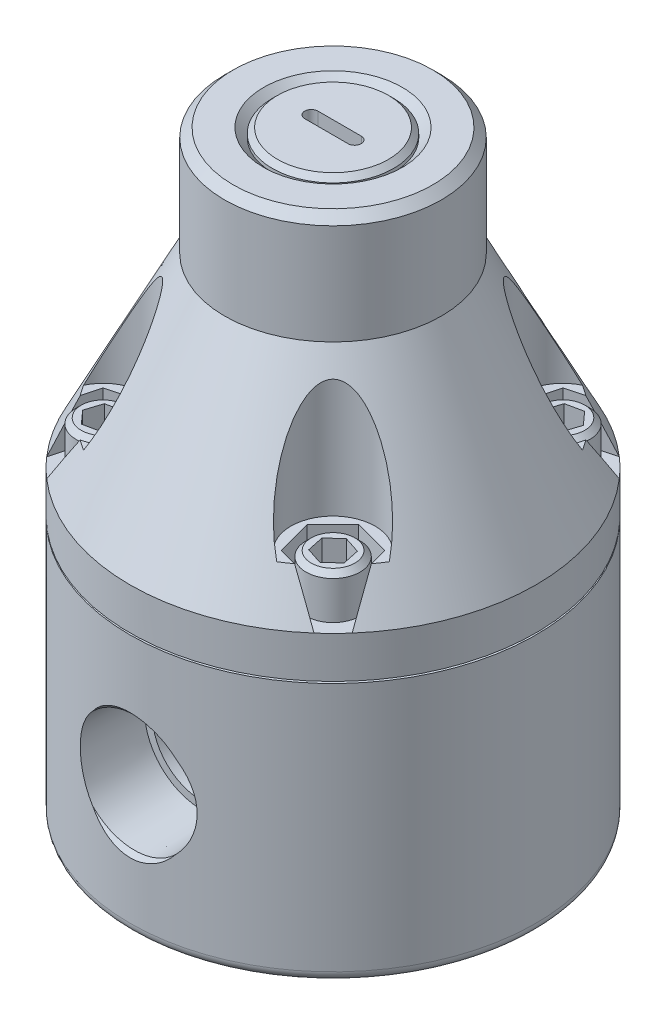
SolidWorks part; units mm, degrees
ref_plane "Front Plane" through (0, 0, 0) normal (0, 0, 1) x (1, 0, 0)
ref_plane "Top Plane" through (0, 0, 0) normal (0, 1, 0) x (1, 0, 0)
ref_plane "Right Plane" through (0, 0, 0) normal (1, 0, 0) x (0, 0, -1)
sketch "Sketch1" plane through (0, 0, 0) normal (0, 1, 0) x (1, 0, 0)
  circle A0 centre (0, 0) radius 29.718
  dimension "D1" = 59.436
extrude "Extrude1" add sketch "Sketch1" along normal blind 87.63
sketch "Sketch2" plane through (0, 0, 0) normal (0, 0, 1) x (1, 0, 0)
  line L0 (0, 0) -> (0, 87.63) construction
  line L1 (29.718, 87.63) -> (-29.718, 87.63) construction
  line L2 (-34.5439, 38.1) -> (-19.05, 38.1)
  line L3 (-19.05, 38.1) -> (-19.05, 38.354)
  line L4 (-19.05, 38.354) -> (-29.718, 38.354)
  line L5 (-15.875, 71.628) -> (-15.875, 89.2885)
  line L6 (-15.875, 89.2885) -> (-34.5439, 89.2885)
  line L7 (-34.5439, 89.2885) -> (-34.5439, 38.1)
  line L8 (-29.718, 87.63) -> (-29.718, 0) construction
  line L9 (-29.718, 38.354) -> (-29.718, 44.45)
  line L10 (-29.718, 0) -> (29.718, 0) construction
  line L11 (-29.718, 44.45) -> (-15.875, 71.628)
  dimension "D1" = 38.1
  dimension "D2" = 0.254
  dimension "D3" = 6.35
  dimension "D4" = 27.178
  dimension "D5" = 15.875
  dimension "D6" = 19.05
revolve "Cut-Revolve1" cut sketch "Sketch2" angle 360 about L0
ref_plane "Plane1" through (0, 87.63, 0) normal (0, 1, 0) x (-1, 0, 0)
sketch "Sketch3" plane through (0, 87.63, 0) normal (0, 1, 0) x (-1, 0, 0)
  circle A0 centre (0, 0) radius 10.16
  dimension "D1" = 20.32
extrude "Extrude2" cut sketch "Sketch3" against normal blind 1.27 draft 45
ref_plane "Plane2" through (0, 0, 29.718) normal (0, 0, 1) x (1, 0, 0)
sketch "Sketch4" plane through (0, 0, 29.718) normal (0, 0, 1) x (1, 0, 0)
  line L0 (0, 0) -> (0, 19.05) construction
  dimension "D1" = 19.05
hole_wizard "3/8 NPT Tapped Hole1" positions "3DSketch3" profile "Sketch6" size "3/8" standard "Ansi Inch"
sketch3d "3DSketch3"
  point P0 (0, 19.05, 29.718)
  point P4 (0, 19.05, 29.718)
sketch "Sketch6" plane through (0, 19.05, 29.718) normal (1, 0, 0) x (0, -1, 0)
  line L0 (0, 0) -> (0, 20.4824)
  line L1 (7.1374, 17.526) -> (0, 20.4824)
  line L2 (-7.1374, 17.526) -> (0, 20.4824) construction
  line L3 (7.1374, 17.526) -> (7.1374, 10.414)
  line L4 (7.1374, 10.414) -> (8.2822, 10.414)
  line L5 (8.2822, 10.414) -> (8.575, 0.635)
  line L6 (8.575, 0.635) -> (9.21, 0)
  line L7 (9.21, 0) -> (0, 0)
  line L8 (0, -6.35) -> (0, 107.95) construction
  line L9 (-8.575, 0.635) -> (-9.21, 0) construction
  line L11 (-7.1374, 10.414) -> (-8.2822, 10.414) construction
  line L12 (-8.2822, 10.414) -> (-8.575, 0.635) construction
  dimension "Tap Drill Dia." = 14.2748
  dimension "Tap Drill Depth" = 17.526
  dimension "Thread Dia." = 17.15
  dimension "Thread Angle" = 3.43
  dimension "Thread Depth" = 10.414
  dimension "C'Sink Dia." = 18.42
  dimension "C'Sink Angle" = 90
  dimension "Drill Angle" = 135
pattern_circular "CirPattern1" count 2 over 360 about axis through (0, 87.63, 0) along (0, -1, 0) of "3/8 NPT Tapped Hole1"
chamfer "Chamfer1" distance 1.27 angle 45 1 edges at (0, 87.63, 15.875)
fillet "Fillet1" radius 1.524 1 edges at (0, 0, 29.718)
sketch "Sketch7" plane through (0, 87.63, 0) normal (0, 1, 0) x (-1, 0, 0)
  circle A0 centre (0, 0) radius 8.89
extrude "Extrude4" add sketch "Sketch7" against normal up to surface (1.27 mm away)
sketch "Sketch10" plane through (0, 87.63, 0) normal (0, 1, 0) x (-1, 0, 0)
  line L0 (-3.175, 0) -> (3.175, 0) construction
  line L1 (-3.175, 0.9652) -> (3.175, 0.9652)
  line L2 (-3.175, -0.9652) -> (3.175, -0.9652)
  arc A0 (-3.175, 0.9652) -> (-3.175, -0.9652) centre (-3.175, 0) ccw
  arc A1 (3.175, 0.9652) -> (3.175, -0.9652) centre (3.175, 0) cw
  dimension "D1" = 3.175
  dimension "D2" = 6.35
  dimension "D3" = 0.9652
  dimension "D4" = 0.9652
  dimension "D5" = 3.175
  dimension "D6" = 6.35
extrude "Extrude5" cut sketch "Sketch10" against normal blind 4.7498
chamfer "Chamfer4" distance 0.762 angle 45 1 edges at (0, 87.63, 8.89)
ref_plane "Plane3" through (0, 50.8, 0) normal (0, 1, 0) x (-1, 0, 0)
sketch "Sketch11" plane through (0, 50.8, 0) normal (0, 1, 0) x (-1, 0, 0)
  line L0 (0, 0) -> (0, -29.718) construction
  line L1 (0, 0) -> (-21.0138, -21.0138) construction
  circle A0 centre (0, 0) radius 23.8125 construction
  circle A1 centre (0, 0) radius 29.718 construction
  circle A2 centre (-16.838, -16.838) radius 6.1722
  dimension "D1" = 47.625
  dimension "D3" = 12.3444
  dimension "D2" = 45
extrude "Extrude6" cut sketch "Sketch11" along normal blind 21.2598
pattern_circular "CirPattern2" count 4 over 360 about axis through (0, 0, 0) along (0, 1, 0) of "Extrude6"
sketch "Sketch12" plane through (0, 50.8, 0) normal (0, 1, 0) x (-1, 0, 0)
  line L0 (0, 0) -> (0, -29.718) construction
  line L1 (0, 0) -> (-21.0138, -21.0138) construction
  line L2 (-16.838, -16.838) -> (-13.5512, -20.1248) construction
  line L3 (-20.6256, -13.0646) -> (-23.3737, -23.3983)
  line L4 (-13.0504, -20.6114) -> (-11.6763, -15.4445)
  line L5 (-11.6763, -15.4445) -> (-15.4639, -11.6711)
  line L6 (-15.4639, -11.6711) -> (-20.6256, -13.0646)
  line L10 (-23.3737, -23.3983) -> (-13.0504, -20.6114)
  line L13 (-21.9996, -18.2314) -> (-18.2121, -22.0048)
  line L14 (-20.6256, -13.0646) -> (-21.9996, -18.2314)
  line L15 (-18.2121, -22.0048) -> (-13.0504, -20.6114)
  circle A0 centre (0, 0) radius 23.8125 construction
  circle A1 centre (0, 0) radius 29.718 construction
  circle A2 centre (-16.838, -16.838) radius 4.6482 construction
  circle A3 centre (-16.838, -16.838) radius 4.6301 construction
  dimension "D1" = 47.625
  dimension "D3" = 9.2964
  dimension "D2" = 45
  dimension "D4" = 4.6482
extrude "Extrude7" cut sketch "Sketch12" against normal blind 6.35
pattern_circular "CirPattern3" count 4 over 360 about axis through (0, 0, 0) along (0, 1, 0) of "Extrude7"
sketch "Sketch13" plane through (0, 50.8, 0) normal (0, 1, 0) x (-1, 0, 0)
  line L0 (0, 0) -> (-21.0073, -21.0203) construction
  arc A0 (-22.3577, -19.5779) -> (-19.564, -22.3698) centre (0, 0) ccw construction
  circle A1 centre (0, 0) radius 23.8125 construction
  circle A2 centre (-16.8328, -16.8432) radius 3.9624
  dimension "D1" = 7.9248
extrude "Extrude8" add sketch "Sketch13" against normal up to surface (6.35 mm away)
sketch "Sketch14" plane through (0, 50.8, 0) normal (0, 1, 0) x (-1, 0, 0)
  line L1 (-15.1431, -18.7188) -> (-14.3636, -16.3177)
  line L2 (-14.3636, -16.3177) -> (-16.0533, -14.4421)
  line L3 (-16.0533, -14.4421) -> (-18.5224, -14.9676)
  line L4 (-18.5224, -14.9676) -> (-19.3019, -17.3687)
  line L5 (-19.3019, -17.3687) -> (-17.6123, -19.2443)
  line L6 (-17.6123, -19.2443) -> (-15.1431, -18.7188)
  circle A0 centre (-16.8328, -16.8432) radius 2.1862 construction
extrude "Extrude9" cut sketch "Sketch14" against normal blind 3.175
chamfer "Chamfer5" distance 0.762 angle 45 1 edges at (16.8328, 50.8, -12.8808)
pattern_circular "CirPattern4" count 4 over 360 about axis through (0, 0, 0) along (0, 1, 0) of "Extrude8", "Extrude9", "Chamfer5"
sketch "Sketch16" plane through (0, 0, 0) normal (0, 1, 0) x (1, 0, 0)
  line L0 (0, 0) -> (-29.718, 0) construction
  line L1 (0, 0) -> (0, -29.718) construction
  circle A0 centre (0, 0) radius 29.718 construction
hole_wizard "3/8 NPT Tapped Hole2" positions "3DSketch7" profile "Sketch20" size "3/8" standard "Ansi Inch"
sketch3d "3DSketch7"
  point P0 (0, 0, 0)
  point P3 (0, 0, 0)
sketch "Sketch20" plane through (0, 0, 0) normal (1, 0, 0) x (0, 0, -1)
  line L0 (0, 0) -> (0, 20.4824)
  line L1 (7.1374, 17.526) -> (0, 20.4824)
  line L2 (-7.1374, 17.526) -> (0, 20.4824) construction
  line L3 (7.1374, 17.526) -> (7.1374, 10.414)
  line L4 (7.1374, 10.414) -> (8.2822, 10.414)
  line L5 (8.2822, 10.414) -> (8.575, 0.635)
  line L6 (8.575, 0.635) -> (9.21, 0)
  line L7 (9.21, 0) -> (0, 0)
  line L8 (0, -6.35) -> (0, 107.95) construction
  line L9 (-8.575, 0.635) -> (-9.21, 0) construction
  line L11 (-7.1374, 10.414) -> (-8.2822, 10.414) construction
  line L12 (-8.2822, 10.414) -> (-8.575, 0.635) construction
  dimension "Tap Drill Dia." = 14.2748
  dimension "Tap Drill Depth" = 17.526
  dimension "Thread Dia." = 17.15
  dimension "Thread Angle" = 3.43
  dimension "Thread Depth" = 10.414
  dimension "C'Sink Dia." = 18.42
  dimension "C'Sink Angle" = 90
  dimension "Drill Angle" = 135
